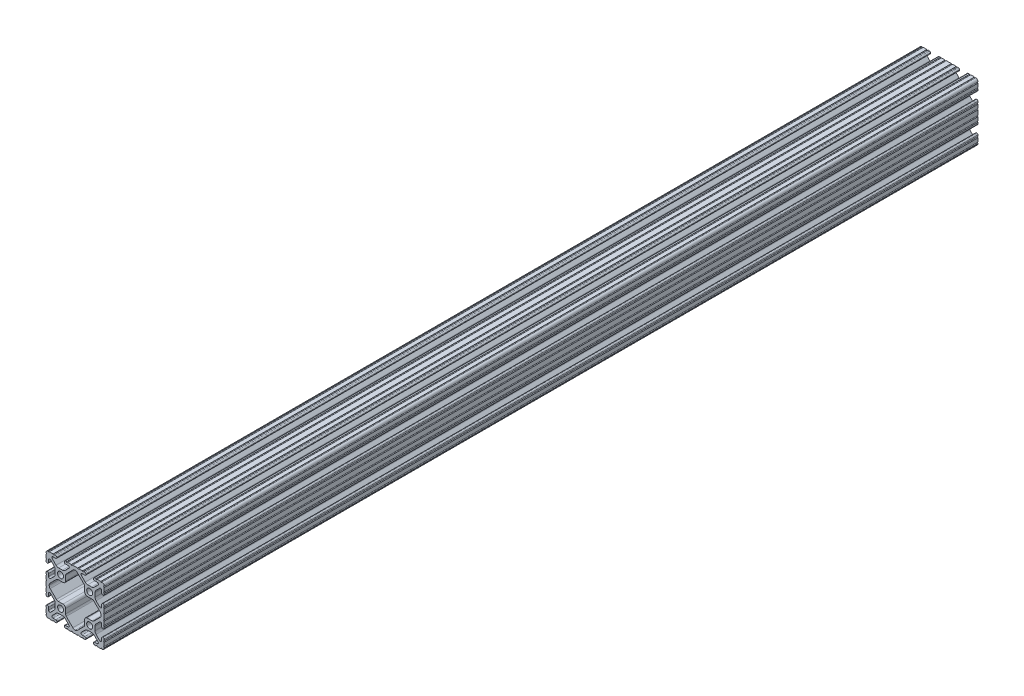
SolidWorks part; units mm, degrees
ref_plane "Front Plane" through (0, 0, 0) normal (0, 0, 1) x (1, 0, 0)
ref_plane "Top Plane" through (0, 0, 0) normal (0, 1, 0) x (1, 0, 0)
ref_plane "Right Plane" through (0, 0, 0) normal (1, 0, 0) x (0, 0, -1)
sketch "Sketch1" plane through (0, 0, 0) normal (0, 0, 1) x (1, 0, 0)
  line L0 (-7.684, -16.0797) -> (-1.9878, -21.7759)
  line L1 (-8.3312, -10.3886) -> (-8.3312, -14.5171)
  line L2 (-14.8165, -8.1788) -> (-10.541, -8.1788)
  line L3 (-21.7734, -2.1502) -> (-16.3772, -7.5334)
  line L4 (-22.6314, 0.0822) -> (-22.6314, -0.0822)
  line L5 (-16.3772, 7.5334) -> (-21.7734, 2.1502)
  line L6 (-10.541, 8.1788) -> (-14.8165, 8.1788)
  line L7 (-8.3312, 14.5171) -> (-8.3312, 10.3886)
  line L8 (-1.7956, 21.9681) -> (-7.684, 16.0797)
  line L9 (7.684, 16.0797) -> (1.7956, 21.9681)
  line L10 (8.3312, 10.389) -> (8.3312, 14.5171)
  line L11 (14.8161, 8.1792) -> (10.541, 8.1792)
  line L12 (21.7734, 2.1502) -> (16.3768, 7.5339)
  line L13 (22.6314, -0.0822) -> (22.6314, 0.0822)
  line L14 (16.3772, -7.5334) -> (21.7734, -2.1502)
  line L15 (10.541, -8.1788) -> (14.8165, -8.1788)
  line L16 (8.3312, -14.5171) -> (8.3312, -10.3886)
  line L17 (1.9878, -21.7759) -> (7.684, -16.0797)
  line L18 (7.4579, -25.3998) -> (8.4051, -25.3998)
  line L19 (9.4615, -24.3585) -> (9.4615, -24.2315)
  line L20 (8.4051, -23.1902) -> (6.0878, -23.1902)
  line L21 (5.388, -21.5008) -> (8.763, -18.1257)
  line L22 (11.0081, -17.1958) -> (14.3919, -17.1958)
  line L23 (16.637, -18.1257) -> (20.012, -21.5008)
  line L24 (19.2977, -23.1901) -> (16.9799, -23.1901)
  line L25 (15.9385, -24.2315) -> (15.9385, -24.3585)
  line L26 (16.9949, -25.3998) -> (18.134, -25.3998)
  line L27 (19.1384, -25.3998) -> (22.4132, -25.3998)
  line L28 (23.4176, -25.3998) -> (23.4501, -25.3998)
  line L29 (25.4, -23.2975) -> (25.4, -23.2686)
  line L30 (25.4, -22.2526) -> (25.4, -19.0252)
  line L31 (25.4, -18.0092) -> (25.4, -16.916)
  line L32 (24.3586, -15.8746) -> (24.2316, -15.8746)
  line L33 (23.1902, -16.916) -> (23.1902, -19.101)
  line L34 (21.4558, -19.8194) -> (18.2781, -16.6418)
  line L35 (17.3482, -14.3967) -> (17.3482, -11.0035)
  line L36 (18.2808, -8.7557) -> (21.4566, -5.5875)
  line L37 (23.1902, -6.3068) -> (23.1902, -8.484)
  line L38 (24.2316, -9.5254) -> (24.3586, -9.5254)
  line L39 (25.4, -8.484) -> (25.4, -7.3277)
  line L40 (25.4, -6.3117) -> (25.4, -3.0843)
  line L41 (25.4, -2.0683) -> (25.4, 2.0683)
  line L42 (25.4, 3.0843) -> (25.4, 6.3117)
  line L43 (25.4, 7.3277) -> (25.4, 8.484)
  line L44 (24.3586, 9.5254) -> (24.2316, 9.5254)
  line L45 (23.1902, 8.484) -> (23.1902, 6.3068)
  line L46 (21.4566, 5.5875) -> (18.2808, 8.7557)
  line L47 (17.3482, 11.0035) -> (17.3482, 14.3967)
  line L48 (18.2781, 16.6418) -> (21.4558, 19.8194)
  line L49 (23.1902, 19.101) -> (23.1902, 16.916)
  line L50 (24.2316, 15.8746) -> (24.3586, 15.8746)
  line L51 (25.4, 16.916) -> (25.4, 18.0092)
  line L52 (25.4, 19.0252) -> (25.4, 22.2526)
  line L53 (25.4, 23.2686) -> (25.4, 23.2975)
  line L54 (23.4501, 25.3998) -> (23.4176, 25.3998)
  line L55 (22.4132, 25.3998) -> (19.1384, 25.3998)
  line L56 (18.134, 25.3998) -> (16.9949, 25.3998)
  line L57 (15.9385, 24.3585) -> (15.9385, 24.2315)
  line L58 (16.9799, 23.1901) -> (19.2977, 23.1901)
  line L59 (20.012, 21.5008) -> (16.637, 18.1257)
  line L60 (14.3919, 17.1958) -> (11.0081, 17.1958)
  line L61 (8.763, 18.1257) -> (5.388, 21.5008)
  line L62 (6.0878, 23.1902) -> (8.4051, 23.1902)
  line L63 (9.4615, 24.2315) -> (9.4615, 24.3585)
  line L64 (8.4051, 25.3998) -> (7.4579, 25.3998)
  line L65 (6.4535, 25.3998) -> (3.2145, 25.3998)
  line L66 (2.2101, 25.3998) -> (-2.2101, 25.3998)
  line L67 (-3.2145, 25.3998) -> (-6.4535, 25.3998)
  line L68 (-7.4579, 25.3998) -> (-8.4051, 25.3998)
  line L69 (-9.4615, 24.3585) -> (-9.4615, 24.2315)
  line L70 (-8.4051, 23.1902) -> (-6.0878, 23.1902)
  line L71 (-5.388, 21.5008) -> (-8.763, 18.1257)
  line L72 (-11.0081, 17.1958) -> (-14.3919, 17.1958)
  line L73 (-16.637, 18.1257) -> (-20.012, 21.5008)
  line L74 (-19.2977, 23.1901) -> (-16.9799, 23.1901)
  line L75 (-15.9385, 24.2315) -> (-15.9385, 24.3585)
  line L76 (-16.9949, 25.3998) -> (-18.134, 25.3998)
  line L77 (-19.1384, 25.3998) -> (-22.4132, 25.3998)
  line L78 (-23.4176, 25.3998) -> (-23.4501, 25.3998)
  line L79 (-25.4, 23.2975) -> (-25.4, 23.2686)
  line L80 (-25.4, 22.2526) -> (-25.4, 19.0252)
  line L81 (-25.4, 18.0092) -> (-25.4, 16.916)
  line L82 (-24.3586, 15.8746) -> (-24.2316, 15.8746)
  line L83 (-23.1902, 16.916) -> (-23.1902, 19.101)
  line L84 (-21.4558, 19.8194) -> (-18.2781, 16.6418)
  line L85 (-17.3482, 14.3967) -> (-17.3482, 11.0035)
  line L86 (-18.2808, 8.7557) -> (-21.4566, 5.5875)
  line L87 (-23.1902, 6.3068) -> (-23.1902, 8.484)
  line L88 (-24.2316, 9.5254) -> (-24.3586, 9.5254)
  line L89 (-25.4, 8.484) -> (-25.4, 7.3277)
  line L90 (-25.4, 6.3117) -> (-25.4, 3.0843)
  line L91 (-25.4, 2.0683) -> (-25.4, -2.0683)
  line L92 (-25.4, -3.0843) -> (-25.4, -6.3117)
  line L93 (-25.4, -7.3277) -> (-25.4, -8.484)
  line L94 (-24.3586, -9.5254) -> (-24.2316, -9.5254)
  line L95 (-23.1902, -8.484) -> (-23.1902, -6.3068)
  line L96 (-21.4566, -5.5875) -> (-18.2808, -8.7557)
  line L97 (-17.3482, -11.0035) -> (-17.3482, -14.3967)
  line L98 (-18.2781, -16.6418) -> (-21.4558, -19.8194)
  line L99 (-23.1902, -19.101) -> (-23.1902, -16.916)
  line L100 (-24.2316, -15.8746) -> (-24.3586, -15.8746)
  line L101 (-25.4, -16.916) -> (-25.4, -18.0092)
  line L102 (-25.4, -19.0252) -> (-25.4, -22.2526)
  line L103 (-25.4, -23.2686) -> (-25.4, -23.2975)
  line L104 (-23.4501, -25.3998) -> (-23.4176, -25.3998)
  line L105 (-22.4132, -25.3998) -> (-19.1384, -25.3998)
  line L106 (-18.134, -25.3998) -> (-16.9949, -25.3998)
  line L107 (-15.9385, -24.3585) -> (-15.9385, -24.2315)
  line L108 (-16.9799, -23.1901) -> (-19.2977, -23.1901)
  line L109 (-20.012, -21.5008) -> (-16.637, -18.1257)
  line L110 (-14.3919, -17.1958) -> (-11.0081, -17.1958)
  line L111 (-8.763, -18.1257) -> (-5.388, -21.5008)
  line L112 (-6.0878, -23.1902) -> (-8.4051, -23.1902)
  line L113 (-9.4615, -24.2315) -> (-9.4615, -24.3585)
  line L114 (-8.4051, -25.3998) -> (-7.4579, -25.3998)
  line L115 (-6.4535, -25.3998) -> (-3.2145, -25.3998)
  line L116 (-2.2101, -25.3998) -> (2.2101, -25.3998)
  line L117 (3.2145, -25.3998) -> (6.4535, -25.3998)
  circle A0 centre (12.7, 12.7) radius 2.6035
  circle A1 centre (-12.7, 12.7) radius 2.6035
  circle A2 centre (-12.7, -12.7) radius 2.6035
  arc A3 (0, -22.6304) -> (1.9878, -21.7759) centre (-0.0777, -19.7104) ccw
  arc A4 (-1.9878, -21.7759) -> (0, -22.6304) centre (0.0777, -19.7104) ccw
  arc A5 (-8.3312, -14.5171) -> (-7.684, -16.0797) centre (-6.1214, -14.5171) ccw
  arc A6 (-8.3312, -10.3886) -> (-10.541, -8.1788) centre (-10.541, -10.3886) ccw
  arc A7 (-16.3772, -7.5334) -> (-14.8165, -8.1788) centre (-14.8165, -5.969) ccw
  arc A8 (-22.6314, -0.0822) -> (-21.7734, -2.1502) centre (-19.7104, -0.0822) ccw
  arc A9 (-21.7734, 2.1502) -> (-22.6314, 0.0822) centre (-19.7104, 0.0822) ccw
  arc A10 (-14.8165, 8.1788) -> (-16.3772, 7.5334) centre (-14.8165, 5.969) ccw
  arc A11 (-10.541, 8.1788) -> (-8.3312, 10.3886) centre (-10.541, 10.3886) ccw
  arc A12 (-7.684, 16.0797) -> (-8.3312, 14.5171) centre (-6.1214, 14.5171) ccw
  arc A13 (0, 22.8111) -> (-1.7956, 21.9681) centre (0.2699, 19.9026) ccw
  arc A14 (1.7956, 21.9681) -> (0, 22.8111) centre (-0.2699, 19.9026) ccw
  arc A15 (8.3312, 14.5171) -> (7.684, 16.0797) centre (6.1214, 14.5171) ccw
  arc A16 (8.3312, 10.389) -> (10.541, 8.1792) centre (10.541, 10.389) ccw
  arc A17 (16.3768, 7.5339) -> (14.8161, 8.1792) centre (14.8161, 5.9694) ccw
  arc A18 (22.6314, 0.0822) -> (21.7734, 2.1502) centre (19.7104, 0.0822) ccw
  arc A19 (21.7734, -2.1502) -> (22.6314, -0.0822) centre (19.7104, -0.0822) ccw
  arc A20 (14.8165, -8.1788) -> (16.3772, -7.5334) centre (14.8165, -5.969) ccw
  arc A21 (10.541, -8.1788) -> (8.3312, -10.3886) centre (10.541, -10.3886) ccw
  arc A22 (7.684, -16.0797) -> (8.3312, -14.5171) centre (6.1214, -14.5171) ccw
  circle A23 centre (12.7, -12.7) radius 2.6035
  arc A24 (7.4579, -25.3998) -> (6.4535, -25.3998) centre (6.9557, -25.3232) ccw
  arc A25 (8.4051, -25.3998) -> (9.4615, -24.3585) centre (8.4201, -24.3585) ccw
  arc A26 (9.4615, -24.2315) -> (8.4051, -23.1902) centre (8.4201, -24.2315) ccw
  arc A27 (5.388, -21.5008) -> (6.0878, -23.1902) centre (6.0878, -22.2006) ccw
  arc A28 (11.0081, -17.1958) -> (8.763, -18.1257) centre (11.0081, -20.3708) ccw
  arc A29 (16.637, -18.1257) -> (14.3919, -17.1958) centre (14.3919, -20.3708) ccw
  arc A30 (19.2977, -23.1901) -> (20.012, -21.5008) centre (19.3122, -22.2006) ccw
  arc A31 (16.9799, -23.1901) -> (15.9385, -24.2315) centre (16.9799, -24.2315) ccw
  arc A32 (15.9385, -24.3585) -> (16.9949, -25.3998) centre (16.9799, -24.3585) ccw
  arc A33 (19.1384, -25.3998) -> (18.134, -25.3998) centre (18.6362, -25.3232) ccw
  arc A34 (23.4176, -25.3998) -> (22.4132, -25.3998) centre (22.9154, -25.3232) ccw
  arc A35 (23.4501, -25.3998) -> (25.4, -23.2975) centre (23.2918, -23.2975) ccw
  arc A36 (25.4, -22.2526) -> (25.4, -23.2686) centre (25.4, -22.7606) ccw
  arc A37 (25.4, -18.0092) -> (25.4, -19.0252) centre (25.4, -18.5172) ccw
  arc A38 (25.4, -16.916) -> (24.3586, -15.8746) centre (24.3586, -16.916) ccw
  arc A39 (24.2316, -15.8746) -> (23.1902, -16.916) centre (24.2316, -16.916) ccw
  arc A40 (21.4558, -19.8194) -> (23.1902, -19.101) centre (22.1742, -19.101) ccw
  arc A41 (17.3482, -14.3967) -> (18.2781, -16.6418) centre (20.5232, -14.3967) ccw
  arc A42 (18.2808, -8.7557) -> (17.3482, -11.0035) centre (20.5232, -11.0035) ccw
  arc A43 (23.1902, -6.3068) -> (21.4566, -5.5875) centre (22.1742, -6.3068) ccw
  arc A44 (23.1902, -8.484) -> (24.2316, -9.5254) centre (24.2316, -8.484) ccw
  arc A45 (24.3586, -9.5254) -> (25.4, -8.484) centre (24.3586, -8.484) ccw
  arc A46 (25.4, -6.3117) -> (25.4, -7.3277) centre (25.4, -6.8197) ccw
  arc A47 (25.4, -2.0683) -> (25.4, -3.0843) centre (25.4, -2.5763) ccw
  arc A48 (25.4, 3.0843) -> (25.4, 2.0683) centre (25.4, 2.5763) ccw
  arc A49 (25.4, 7.3277) -> (25.4, 6.3117) centre (25.4, 6.8197) ccw
  arc A50 (25.4, 8.484) -> (24.3586, 9.5254) centre (24.3586, 8.484) ccw
  arc A51 (24.2316, 9.5254) -> (23.1902, 8.484) centre (24.2316, 8.484) ccw
  arc A52 (21.4566, 5.5875) -> (23.1902, 6.3068) centre (22.1742, 6.3068) ccw
  arc A53 (17.3482, 11.0035) -> (18.2808, 8.7557) centre (20.5232, 11.0035) ccw
  arc A54 (18.2781, 16.6418) -> (17.3482, 14.3967) centre (20.5232, 14.3967) ccw
  arc A55 (23.1902, 19.101) -> (21.4558, 19.8194) centre (22.1742, 19.101) ccw
  arc A56 (23.1902, 16.916) -> (24.2316, 15.8746) centre (24.2316, 16.916) ccw
  arc A57 (24.3586, 15.8746) -> (25.4, 16.916) centre (24.3586, 16.916) ccw
  arc A58 (25.4, 19.0252) -> (25.4, 18.0092) centre (25.4, 18.5172) ccw
  arc A59 (25.4, 23.2686) -> (25.4, 22.2526) centre (25.4, 22.7606) ccw
  arc A60 (25.4, 23.2975) -> (23.4501, 25.3998) centre (23.2918, 23.2975) ccw
  arc A61 (22.4132, 25.3998) -> (23.4176, 25.3998) centre (22.9154, 25.3232) ccw
  arc A62 (18.134, 25.3998) -> (19.1384, 25.3998) centre (18.6362, 25.3232) ccw
  arc A63 (16.9949, 25.3998) -> (15.9385, 24.3585) centre (16.9799, 24.3585) ccw
  arc A64 (15.9385, 24.2315) -> (16.9799, 23.1901) centre (16.9799, 24.2315) ccw
  arc A65 (20.012, 21.5008) -> (19.2977, 23.1901) centre (19.3122, 22.2006) ccw
  arc A66 (14.3919, 17.1958) -> (16.637, 18.1257) centre (14.3919, 20.3708) ccw
  arc A67 (8.763, 18.1257) -> (11.0081, 17.1958) centre (11.0081, 20.3708) ccw
  arc A68 (6.0878, 23.1902) -> (5.388, 21.5008) centre (6.0878, 22.2006) ccw
  arc A69 (8.4051, 23.1902) -> (9.4615, 24.2315) centre (8.4201, 24.2315) ccw
  arc A70 (9.4615, 24.3585) -> (8.4051, 25.3998) centre (8.4201, 24.3585) ccw
  arc A71 (6.4535, 25.3998) -> (7.4579, 25.3998) centre (6.9557, 25.3232) ccw
  arc A72 (2.2101, 25.3998) -> (3.2145, 25.3998) centre (2.7123, 25.3232) ccw
  arc A73 (-3.2145, 25.3998) -> (-2.2101, 25.3998) centre (-2.7123, 25.3232) ccw
  arc A74 (-7.4579, 25.3998) -> (-6.4535, 25.3998) centre (-6.9557, 25.3232) ccw
  arc A75 (-8.4051, 25.3998) -> (-9.4615, 24.3585) centre (-8.4201, 24.3585) ccw
  arc A76 (-9.4615, 24.2315) -> (-8.4051, 23.1902) centre (-8.4201, 24.2315) ccw
  arc A77 (-5.388, 21.5008) -> (-6.0878, 23.1902) centre (-6.0878, 22.2006) ccw
  arc A78 (-11.0081, 17.1958) -> (-8.763, 18.1257) centre (-11.0081, 20.3708) ccw
  arc A79 (-16.637, 18.1257) -> (-14.3919, 17.1958) centre (-14.3919, 20.3708) ccw
  arc A80 (-19.2977, 23.1901) -> (-20.012, 21.5008) centre (-19.3122, 22.2006) ccw
  arc A81 (-16.9799, 23.1901) -> (-15.9385, 24.2315) centre (-16.9799, 24.2315) ccw
  arc A82 (-15.9385, 24.3585) -> (-16.9949, 25.3998) centre (-16.9799, 24.3585) ccw
  arc A83 (-19.1384, 25.3998) -> (-18.134, 25.3998) centre (-18.6362, 25.3232) ccw
  arc A84 (-23.4176, 25.3998) -> (-22.4132, 25.3998) centre (-22.9154, 25.3232) ccw
  arc A85 (-23.4501, 25.3998) -> (-25.4, 23.2975) centre (-23.2918, 23.2975) ccw
  arc A86 (-25.4, 22.2526) -> (-25.4, 23.2686) centre (-25.4, 22.7606) ccw
  arc A87 (-25.4, 18.0092) -> (-25.4, 19.0252) centre (-25.4, 18.5172) ccw
  arc A88 (-25.4, 16.916) -> (-24.3586, 15.8746) centre (-24.3586, 16.916) ccw
  arc A89 (-24.2316, 15.8746) -> (-23.1902, 16.916) centre (-24.2316, 16.916) ccw
  arc A90 (-21.4558, 19.8194) -> (-23.1902, 19.101) centre (-22.1742, 19.101) ccw
  arc A91 (-17.3482, 14.3967) -> (-18.2781, 16.6418) centre (-20.5232, 14.3967) ccw
  arc A92 (-18.2808, 8.7557) -> (-17.3482, 11.0035) centre (-20.5232, 11.0035) ccw
  arc A93 (-23.1902, 6.3068) -> (-21.4566, 5.5875) centre (-22.1742, 6.3068) ccw
  arc A94 (-23.1902, 8.484) -> (-24.2316, 9.5254) centre (-24.2316, 8.484) ccw
  arc A95 (-24.3586, 9.5254) -> (-25.4, 8.484) centre (-24.3586, 8.484) ccw
  arc A96 (-25.4, 6.3117) -> (-25.4, 7.3277) centre (-25.4, 6.8197) ccw
  arc A97 (-25.4, 2.0683) -> (-25.4, 3.0843) centre (-25.4, 2.5763) ccw
  arc A98 (-25.4, -3.0843) -> (-25.4, -2.0683) centre (-25.4, -2.5763) ccw
  arc A99 (-25.4, -7.3277) -> (-25.4, -6.3117) centre (-25.4, -6.8197) ccw
  arc A100 (-25.4, -8.484) -> (-24.3586, -9.5254) centre (-24.3586, -8.484) ccw
  arc A101 (-24.2316, -9.5254) -> (-23.1902, -8.484) centre (-24.2316, -8.484) ccw
  arc A102 (-21.4566, -5.5875) -> (-23.1902, -6.3068) centre (-22.1742, -6.3068) ccw
  arc A103 (-17.3482, -11.0035) -> (-18.2808, -8.7557) centre (-20.5232, -11.0035) ccw
  arc A104 (-18.2781, -16.6418) -> (-17.3482, -14.3967) centre (-20.5232, -14.3967) ccw
  arc A105 (-23.1902, -19.101) -> (-21.4558, -19.8194) centre (-22.1742, -19.101) ccw
  arc A106 (-23.1902, -16.916) -> (-24.2316, -15.8746) centre (-24.2316, -16.916) ccw
  arc A107 (-24.3586, -15.8746) -> (-25.4, -16.916) centre (-24.3586, -16.916) ccw
  arc A108 (-25.4, -19.0252) -> (-25.4, -18.0092) centre (-25.4, -18.5172) ccw
  arc A109 (-25.4, -23.2686) -> (-25.4, -22.2526) centre (-25.4, -22.7606) ccw
  arc A110 (-25.4, -23.2975) -> (-23.4501, -25.3998) centre (-23.2918, -23.2975) ccw
  arc A111 (-22.4132, -25.3998) -> (-23.4176, -25.3998) centre (-22.9154, -25.3232) ccw
  arc A112 (-18.134, -25.3998) -> (-19.1384, -25.3998) centre (-18.6362, -25.3232) ccw
  arc A113 (-16.9949, -25.3998) -> (-15.9385, -24.3585) centre (-16.9799, -24.3585) ccw
  arc A114 (-15.9385, -24.2315) -> (-16.9799, -23.1901) centre (-16.9799, -24.2315) ccw
  arc A115 (-20.012, -21.5008) -> (-19.2977, -23.1901) centre (-19.3122, -22.2006) ccw
  arc A116 (-14.3919, -17.1958) -> (-16.637, -18.1257) centre (-14.3919, -20.3708) ccw
  arc A117 (-8.763, -18.1257) -> (-11.0081, -17.1958) centre (-11.0081, -20.3708) ccw
  arc A118 (-6.0878, -23.1902) -> (-5.388, -21.5008) centre (-6.0878, -22.2006) ccw
  arc A119 (-8.4051, -23.1902) -> (-9.4615, -24.2315) centre (-8.4201, -24.2315) ccw
  arc A120 (-9.4615, -24.3585) -> (-8.4051, -25.3998) centre (-8.4201, -24.3585) ccw
  arc A121 (-6.4535, -25.3998) -> (-7.4579, -25.3998) centre (-6.9557, -25.3232) ccw
  arc A122 (-2.2101, -25.3998) -> (-3.2145, -25.3998) centre (-2.7123, -25.3232) ccw
  arc A123 (3.2145, -25.3998) -> (2.2101, -25.3998) centre (2.7123, -25.3232) ccw
extrude "Extrude1" add sketch "Sketch1" against normal mid plane 762
